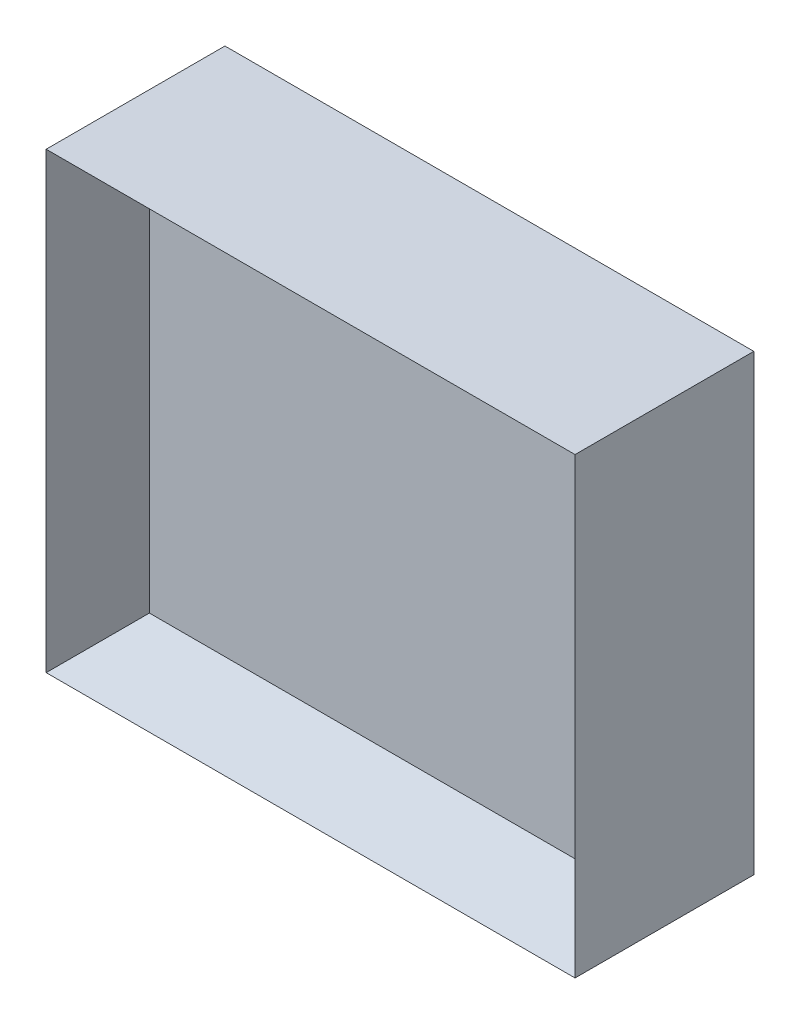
SolidWorks part; units mm, degrees
ref_plane "Front Plane" through (0, 0, 0) normal (0, 0, 1) x (1, 0, 0)
ref_plane "Top Plane" through (0, 0, 0) normal (0, 1, 0) x (1, 0, 0)
ref_plane "Right Plane" through (0, 0, 0) normal (1, 0, 0) x (0, 0, -1)
sketch "Sketch1" plane through (0, 0, 0) normal (0, 0, 1) x (1, 0, 0)
  line L1 (44.45, -38.1) -> (-44.45, -38.1)
  line L2 (44.45, -38.1) -> (44.45, 38.1)
  line L3 (44.45, 38.1) -> (-44.45, 38.1)
  line L4 (-44.45, -38.1) -> (-44.45, 38.1)
  line L6 (44.45, 38.1) -> (-44.45, -38.1) construction
  point P0 (0, 0)
  dimension "D1" = 88.9
  dimension "D2" = 76.2
extrude "Boss-Extrude1" add sketch "Sketch1" along normal mid plane 38.1
sketch "Sketch2" plane through (0, 0, 0) normal (0, 0, 1) x (1, 0, 0)
  line L1 (38.1, 31.75) -> (-38.1, 31.75)
  line L2 (38.1, 31.75) -> (38.1, -31.75)
  line L3 (38.1, -31.75) -> (-38.1, -31.75)
  line L4 (-38.1, 31.75) -> (-38.1, -31.75)
  line L5 (38.1, 31.75) -> (-38.1, -31.75) construction
  line L6 (38.1, -31.75) -> (-38.1, 31.75) construction
  point P0 (0, 0)
  dimension "D1" = 63.5
  dimension "D2" = 76.2
extrude "Cut-Extrude1" cut sketch "Sketch2" along normal blind 30.48 draft 30
